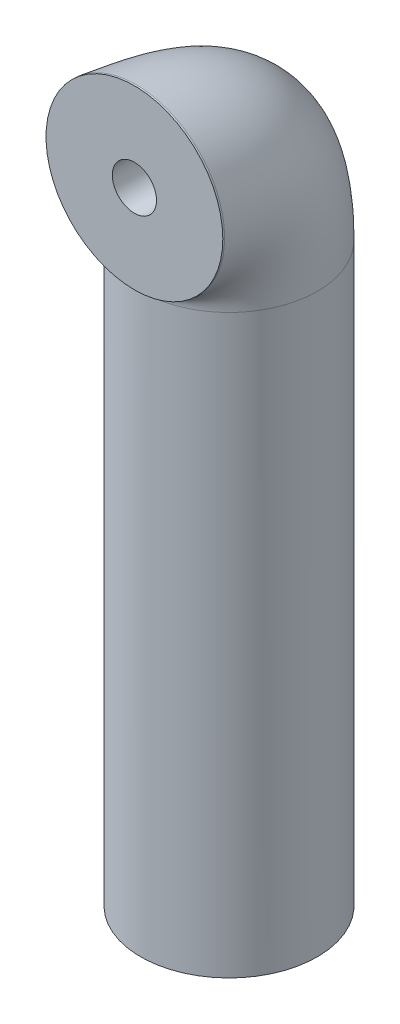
SolidWorks part; units mm, degrees
ref_plane "Ebene vorne" through (0, 0, 0) normal (0, 0, 1) x (1, 0, 0)
ref_plane "Ebene oben" through (0, 0, 0) normal (0, 1, 0) x (1, 0, 0)
ref_plane "Ebene rechts" through (0, 0, 0) normal (1, 0, 0) x (0, 0, -1)
sketch "Skizze1" plane through (0, 0, 0) normal (0, 0, 1) x (1, 0, 0)
  circle A0 centre (0, 0) radius 100
  dimension "D1" = 200
extrude "Aufsatz-Linear austragen1" add sketch "Skizze1" along normal blind 2
sketch "Skizze2" plane through (0, 0, 2) normal (0, 0, 1) x (1, 0, 0)
  circle A0 centre (0, 0) radius 25
  dimension "D1" = 50
extrude "Aufsatz-Linear austragen2" add sketch "Skizze2" along normal blind 50
ref_plane "Ebene1" through (0, 105, 0) normal (0, 1, 0) x (1, 0, 0)
sketch "Skizze4" plane through (0, 105, 0) normal (0, 1, 0) x (1, 0, 0)
  circle A0 centre (0, 105) radius 100
  dimension "D1" = 200
  dimension "D2" = 105
other "Begrenzung1"
sketch "Skizze5" plane through (0, 105, 0) normal (0, 1, 0) x (1, 0, 0)
  circle A1 centre (0, 105) radius 100 construction
  circle A2 centre (0, 105) radius 98
  circle A3 centre (0, 105) radius 98
  circle A4 centre (0, 105) radius 100
  dimension "D1" = 2
extrude "Aufsatz-Linear austragen3" add sketch "Skizze5" along normal blind 300
mirror "Spiegeln2" about plane through (0, 405, -105) normal (0, 1, 0)
sketch "Skizze6" plane through (0, 0, 52) normal (0, 0, 1) x (1, 0, 0)
  circle A2 centre (0, 810) radius 25
  circle A3 centre (0, 810) radius 25
  dimension "D1" = 0
extrude "Schnitt-Linear austragen1" cut sketch "Skizze6" against normal blind 100
sketch "Skizze7" plane through (0, 105, 0) normal (0, 1, 0) x (1, 0, 0)
  line L1 (-191.6655, 243.8114) -> (180.9218, 243.8114)
  line L2 (-191.6655, 243.8114) -> (-191.6655, -81.9332)
  line L3 (-191.6655, -81.9332) -> (180.9218, -81.9332)
  line L4 (180.9218, 243.8114) -> (180.9218, -81.9332)
  line L5 (-191.6655, 243.8114) -> (180.9218, -81.9332) construction
  line L6 (-191.6655, -81.9332) -> (180.9218, 243.8114) construction
  point P4 (-5.3718, 80.9391)
  point P5 (-191.6655, 243.8114)
  point P6 (180.9218, -81.9332)
extrude "Schnitt-Linear austragen3" cut sketch "Skizze7" against normal blind 250
sketch "Skizze8" plane through (0, 105, 0) normal (0, -1, 0) x (1, 0, 0)
  circle A1 centre (0, -105) radius 100
  circle A2 centre (0, -105) radius 100
  dimension "D1" = 0
extrude "Aufsatz-Linear austragen4" add sketch "Skizze8" along normal blind 52
sketch "Skizze9" plane through (0, 53, 0) normal (0, -1, 0) x (1, 0, 0)
  circle A0 centre (0, -105) radius 25
  dimension "D1" = 50
extrude "Schnitt-Linear austragen4" cut sketch "Skizze9" against normal blind 50
